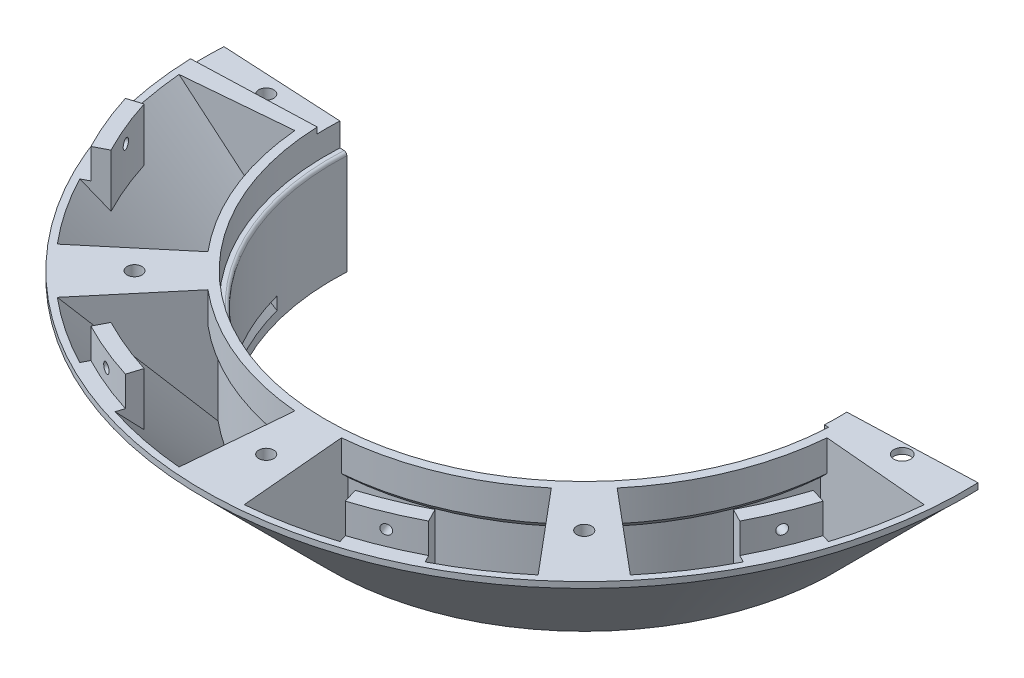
SolidWorks part; units mm, degrees
ref_plane "Front Plane" through (0, 0, 0) normal (0, 0, 1) x (1, 0, 0)
ref_plane "Top Plane" through (0, 0, 0) normal (0, 1, 0) x (1, 0, 0)
ref_plane "Right Plane" through (0, 0, 0) normal (1, 0, 0) x (0, 0, -1)
ref_axis "Axis1" through (0, 55.6325, 0) along (0, -1, 0)
ref_plane "Plane2" through (0, 0, 0) normal (0.0872, 0, 0.9962) x (0, -1, 0)
sketch "Sketch1" plane through (0, 0, 0) normal (0, 0, 1) x (1, 0, 0)
  line L0 (0, 0) -> (0, 51.4902) construction
  line L3 (-117.8838, 25.146) -> (-109.7915, 25.146)
  line L4 (-109.7915, 25.146) -> (-109.7915, 12.7)
  line L5 (-109.7915, 12.7) -> (-107.9627, 12.7)
  line L6 (-106.6927, 11.43) -> (-106.6927, -31.3563)
  line L8 (-161.925, 22.606) -> (-161.925, 25.146)
  line L9 (-117.8838, 25.146) -> (-161.925, 25.146)
  line L10 (-161.925, 22.606) -> (-107.9627, -31.3563)
  line L11 (-107.9627, -31.3563) -> (-106.6927, -31.3563)
  line L12 (-109.5375, 12.7) -> (109.5375, 12.7) construction
  line L14 (-106.4387, 11.43) -> (-106.4387, -798.83) construction
  line L15 (-109.5375, 25.4) -> (-109.5375, 12.7) construction
  arc A0 (-107.9627, 12.7) -> (-106.6927, 11.43) centre (-107.9627, 11.43) cw
  dimension "D4" = 1.27
  dimension "D1" = 1.27
  dimension "D2" = 0.254
  dimension "D3" = 2.54
  dimension "D5" = 0.254
  dimension "D6" = 0.254
  dimension "D7" = 45
  dimension "D8" = 323.85
revolve "Revolve1" add sketch "Sketch1" angle 360 about L0
hole_wizard "1/4-20 Tapped Hole1" positions "Sketch16" profile "Sketch15" tap size "1/4-20" standard "ANSI Inch"
sketch "Sketch16" plane through (0, 25.146, 0) normal (0, -1, 0) x (-1, 0, 0)
  point P0 (-135.255, 0)
sketch "Sketch15" plane through (135.255, 25.146, 0) normal (1, 0, 0) x (0, 0, 1)
  line L0 (0, 0) -> (0, 18.0438)
  line L1 (0, 18.0438) -> (2.5527, 16.51)
  line L2 (2.5527, 16.51) -> (2.5527, 12.7)
  line L3 (2.5527, 12.7) -> (3.175, 12.7)
  line L4 (3.175, 12.7) -> (3.175, 0)
  line L5 (3.175, 0) -> (0, 0)
  line L10 (0, 18.0438) -> (-2.5527, 16.51) construction
  line L11 (0, -6.35) -> (0, 107.95) construction
  dimension "Tap Drill Dia." = 5.1054
  dimension "Tap Drill Depth" = 16.51
  dimension "Thread Major Dia." = 6.35
  dimension "Thread Depth" = 12.7
  dimension "Drill Angle" = 118
pattern_circular "CirPattern1" count 8 over 360 about axis through (0, 0, 0) along (0, 1, 0) of "1/4-20 Tapped Hole1"
ref_plane "Plane3" through (0, 0, 0) normal (-0.7071, 0, -0.7071) x (-0.7071, 0, 0.7071)
ref_plane "Plane4" through (0, 0, 0) normal (0, 0, -1) x (-1, 0, 0)
ref_plane "Plane5" through (0, 0, 0) normal (-0.3827, 0, -0.9239) x (-0.9239, 0, 0.3827)
sketch "Sketch25" plane through (-153.4698, 0, 63.5693) normal (-0.3827, 0, -0.9239) x (-0.9239, 0, 0.3827)
  line L0 (-279.716, 25.146) -> (-279.716, 11.9888)
  line L1 (-4.1895, 25.146) -> (-328.0395, 25.146) construction
  line L2 (-279.716, 11.9888) -> (-276.6172, 8.89)
  line L3 (-276.6172, 8.89) -> (-276.6172, -23.4281)
  line L4 (-276.6172, -23.4281) -> (-325.1914, 25.146)
  line L6 (-325.1914, 25.146) -> (-279.716, 25.146)
  line L7 (-275.906, 12.7) -> (-278.1666, 10.4394) construction
  line L8 (-328.0395, 22.606) -> (-274.0772, -31.3563) construction
  point P8 (-272.8072, -31.3563)
  point P11 (-275.906, 25.146)
  dimension "D1" = 3.81
  dimension "D2" = 3.81
  dimension "D3" = 135
  dimension "D4" = 3.81
revolve "Cut-Revolve2" cut sketch "Sketch25" angle 35 mid plane about axis through (0, 55.6325, 0) along (0, -1, 0)
sketch "Sketch26" plane through (0, 0, 0) normal (-0.3827, 0, -0.9239) x (-0.9239, 0, 0.3827)
  line L0 (-110.5027, -23.4281) -> (-106.6927, -27.2381)
  line L1 (-106.6927, 11.43) -> (-106.6927, -31.3563) construction
  line L2 (-159.0768, 25.146) -> (-110.5027, -23.4281) construction
  line L3 (-106.6927, -27.2381) -> (-106.6927, -21.85)
  line L4 (-106.6927, 11.43) -> (-106.6927, -31.3563) construction
  line L5 (-106.6927, -21.85) -> (-110.5027, -18.04)
  line L6 (-110.5027, 8.89) -> (-110.5027, -23.4281) construction
  line L7 (-110.5027, -18.04) -> (-110.5027, -23.4281)
  dimension "D1" = 3.81
revolve "Cut-Revolve3" cut sketch "Sketch26" angle 15 mid plane about axis through (0, 55.6325, 0) along (0, -1, 0)
sketch "Sketch31" plane through (0, 0, 0) normal (-0.3827, 0, -0.9239) x (-0.9239, 0, 0.3827)
  line L0 (-159.0768, 25.146) -> (-149.225, 15.2942)
  line L3 (-159.0768, 25.146) -> (-106.6927, -27.2381) construction
  line L4 (-149.225, 15.2942) -> (-149.225, 37.846)
  line L5 (-155.575, 37.846) -> (-155.575, 25.146)
  line L6 (-159.0768, 25.146) -> (-113.6015, 25.146) construction
  line L7 (-155.575, 25.146) -> (-159.0768, 25.146)
  line L8 (-149.225, 37.846) -> (-155.575, 37.846)
  line L9 (0, 0) -> (0, 58.613) construction
  line L10 (-110.5027, -23.4281) -> (-159.0768, 25.146) construction
  dimension "D1" = 311.15
  dimension "D2" = 6.35
  dimension "D3" = 12.7
revolve "Revolve4" add sketch "Sketch31" angle 10 mid plane about L9
hole_wizard "#8-32 Tapped Hole1" positions "3DSketch1" profile "Sketch32" tap size "#8-32" standard "ANSI Inch"
sketch3d "3DSketch1"
  line L0 (143.7326, 37.846, -59.536) -> (143.7326, 25.146, -59.536) construction
  arc A0 (137.9967, 37.846, -71.8365) -> (148.3745, 37.846, -46.7823) centre (0, 37.846, 0) ccw construction
  arc A1 (137.9967, 25.146, -71.8365) -> (148.3745, 25.146, -46.7823) centre (0, 25.146, 0) ccw construction
  point P6 (0, -117.729, 0)
  point P10 (0, -130.429, 0)
  point P12 (143.7326, 31.496, -59.536)
  point P15 (143.7326, 31.496, -59.536)
sketch "Sketch32" plane through (143.7326, 31.496, -59.536) normal (0, 1, 0) x (-0.3827, 0, -0.9239)
  line L0 (0, 0) -> (0, 367.1402)
  line L1 (0, 367.1402) -> (2.0828, 367.1402)
  line L2 (2.0828, 367.1402) -> (2.0828, 0)
  line L5 (2.0828, 0) -> (0, 0)
  line L11 (0, -6.35) -> (0, 107.95) construction
  dimension "Thread Major Dia." = 4.1656
  dimension "Thru Tap Drill Depth" = 367.1402
pattern_circular "CirPattern2" count 8 over 360 about axis through (0, 0, 0) along (0, 1, 0) of "Cut-Revolve2", "Cut-Revolve3", "Revolve4", "#8-32 Tapped Hole1"
sketch "Sketch21" plane through (0, 37.846, 0) normal (0, -1, 0) x (1, 0, 0)
  line L0 (-161.7031, -8.4745) -> (161.925, 8.4861)
  line L1 (0, 0) -> (100.5903, 0) construction
  line L3 (-161.7031, -8.4745) -> (-161.7031, -168.577)
  line L4 (-161.7031, -168.577) -> (161.925, -168.577)
  line L5 (161.925, -168.577) -> (161.925, 8.4861)
  circle A0 centre (0, 0) radius 161.925 construction
  circle A1 centre (0, 0) radius 161.925 construction
  dimension "D1" = 3
extrude "Cut-Extrude1" cut sketch "Sketch21" along normal through all
sketch "Sketch22" plane through (0, 25.146, 0) normal (0, 1, 0) x (1, 0, 0)
  line L0 (-161.8264, -5.6511) -> (-107.8969, -3.7678)
  line L1 (-161.7031, 8.4745) -> (-107.8147, 5.6503)
  line L2 (-107.8969, -3.7678) -> (0, 0) construction
  arc A0 (-107.8147, 5.6503) -> (-107.8969, -3.7678) centre (0, 0) ccw
  arc A1 (-161.7031, 8.4745) -> (-161.8264, -5.6511) centre (0, 0) ccw
  dimension "D1" = 5
extrude "Cut-Extrude2" cut sketch "Sketch22" against normal up to vertex (3.175 mm away)
sketch "Sketch23" plane through (0, 25.146, 0) normal (0, 1, 0) x (1, 0, 0)
  line L0 (107.8969, 3.7678) -> (161.8264, 5.6511)
  line L1 (107.8147, -5.6503) -> (161.7031, -8.4745)
  line L2 (0, 0) -> (107.8969, 3.7678) construction
  arc A0 (107.8147, -5.6503) -> (107.8969, 3.7678) centre (0, 0) ccw
  arc A1 (161.7031, -8.4745) -> (161.8264, 5.6511) centre (0, 0) ccw
  dimension "D1" = 5
extrude "Boss-Extrude6" add sketch "Sketch23" against normal up to surface (2.54 mm away)
hole_wizard "9/32 (0.28125) Diameter Hole1" positions "Sketch28" profile "Sketch27" hole size "9/32" standard "ANSI Inch"
sketch "Sketch28" plane through (0, 25.146, 0) normal (0, 1, 0) x (1, 0, 0)
  line L0 (-135.255, 0) -> (135.255, 0) construction
  point P0 (135.255, 0)
sketch "Sketch27" plane through (135.255, 25.146, 0) normal (1, 0, 0) x (0, 0, 1)
  line L0 (0, 0) -> (0, 56.5023)
  line L1 (0, 56.5023) -> (3.5719, 56.5023)
  line L2 (3.5719, 56.5023) -> (3.5719, 0)
  line L5 (3.5719, 0) -> (0, 0)
  line L11 (0, -6.35) -> (0, 107.95) construction
  dimension "Thru Hole Dia." = 7.1437
  dimension "Thru Hole Depth" = 56.5023
